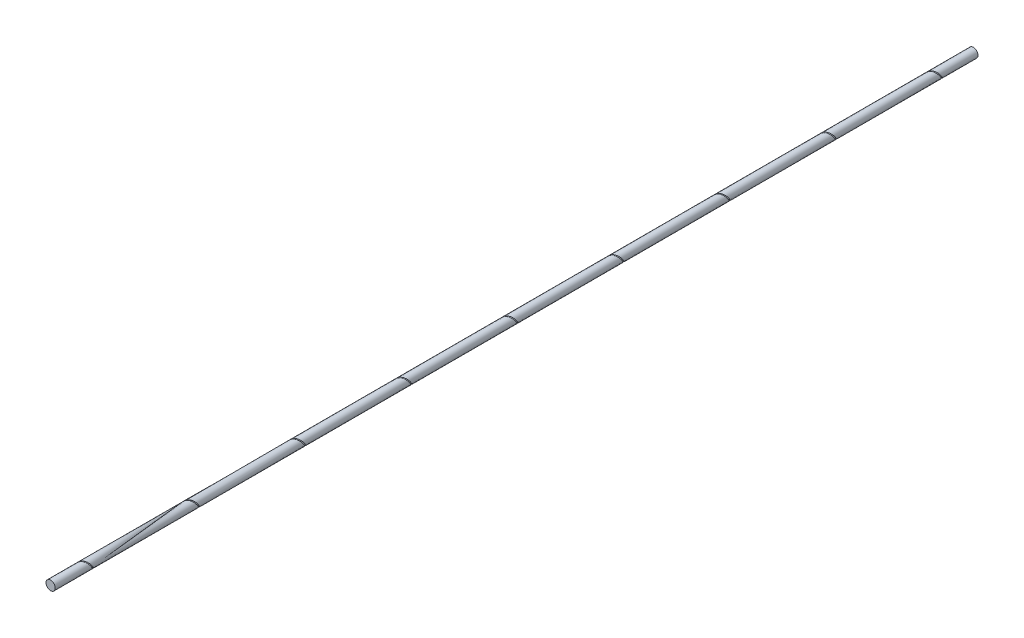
SolidWorks part; units mm, degrees
ref_plane "Front Plane" through (0, 0, 0) normal (0, 0, 1) x (1, 0, 0)
ref_plane "Top Plane" through (0, 0, 0) normal (0, 1, 0) x (1, 0, 0)
ref_plane "Right Plane" through (0, 0, 0) normal (1, 0, 0) x (0, 0, -1)
sketch "Sketch1" plane through (0, 0, 0) normal (0, 0, 1) x (1, 0, 0)
  circle A0 centre (0, 0) radius 25
  dimension "D1" = 50
extrude "Boss-Extrude1" add sketch "Sketch1" along normal blind 5000
ref_plane "Plane1" through (0, 0, 150) normal (0, 0, 1) x (1, 0, 0)
sketch "Sketch2" plane through (0, 0, 150) normal (0, 0, 1) x (1, 0, 0)
  circle A0 centre (0, 0) radius 27.646
  dimension "D1" = 55.292
curve "Helix/Spiral1"
sketch "Sketch3" plane through (0, 0, 0) normal (0, 1, 0) x (1, 0, 0)
  circle A0 centre (-27.646, -150) radius 3.969
  spline S0 degree 3 poles (-27.646, -150) (-27.646, -151.3307) (-27.0608, -154.0012) (-24.4828, -157.9997) (-20.3663, -162.0001) (-14.9702, -166) (-8.6335, -170) (-1.7543, -174) (5.2352, -178) (11.8957, -182) (17.8087, -186) (22.6028, -190) (25.9766, -194) (27.7183, -198) (27.7183, -202) (25.9766, -206) (22.6028, -210) (17.8087, -214) (11.8957, -218) (5.2352, -222) (-1.7543, -226) (-8.6335, -230) (-14.9702, -234) (-20.3663, -237.9999) (-24.4828, -242.0003) (-27.0608, -245.9988) (-27.646, -248.6693) (-27.646, -250) knots 0 0 0 0 0.04 0.08 0.12 0.16 0.2 0.24 0.28 0.32 0.36 0.4 0.44 0.48 0.52 0.56 0.6 0.64 0.68 0.72 0.76 0.8 0.84 0.88 0.92 0.96 1 1 1 1 construction
  dimension "D1" = 7.938
sweep "Cut-Sweep1" cut profiles "Sketch3" path "Helix/Spiral1"
pattern_linear "LPattern1" count 9 spacing 575 along (0, 0, -1) of "Cut-Sweep1"
